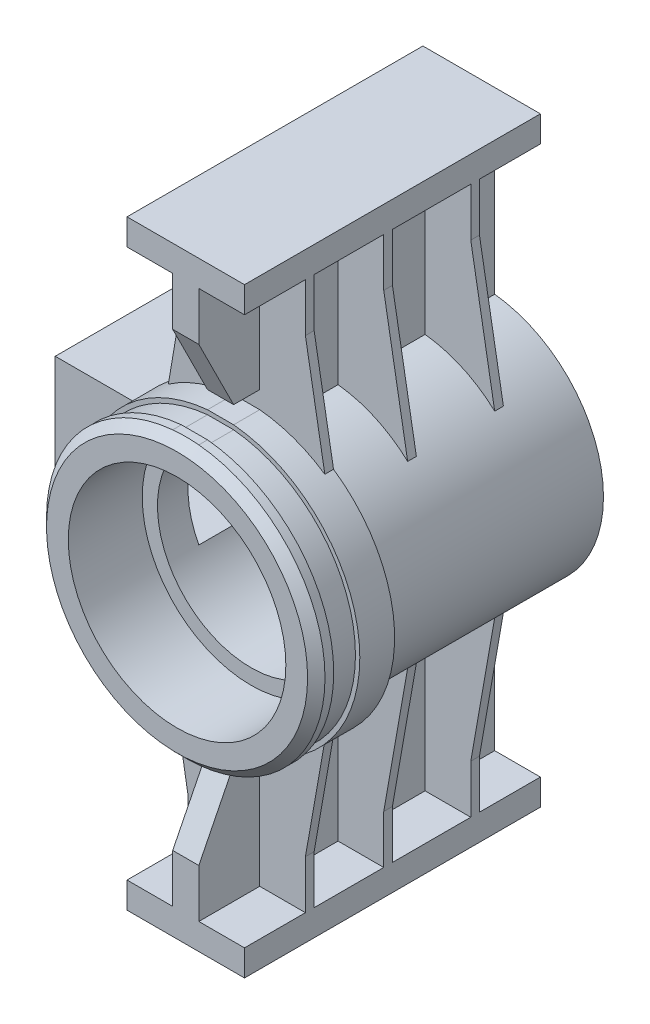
SolidWorks part; units mm, degrees
ref_plane "Plane1" through (0, 0, 0) normal (0, 0, 1) x (1, 0, 0)
ref_plane "Plane2" through (0, 0, 0) normal (0, 1, 0) x (1, 0, 0)
ref_plane "Plane3" through (0, 0, 0) normal (1, 0, 0) x (0, 0, -1)
sketch "Esquisse1" plane through (0, 0, 0) normal (0, 0, 1) x (1, 0, 0)
  circle A0 centre (0, 0) radius 16
  dimension "D1" = 32
extrude "Base-Extrusion" add sketch "Esquisse1" along normal blind 35
chamfer "Chanfrein1" distance 1 angle 45
ref_plane "Plan4" through (0, 0, 33) normal (0, 0, 1) x (1, 0, 0)
sketch "Esquisse2" plane through (0, 0, 33) normal (0, 0, 1) x (1, 0, 0)
  circle A0 centre (0, 0) radius 15.5
  dimension "D1" = 31
extrude "Enlèv. de mat.-Extru.-Mince1" cut sketch "Esquisse2" against normal blind 3 thin
ref_plane "Plan5" through (0, 0, 26) normal (0, 0, 1) x (1, 0, 0)
sketch "Esquisse3" plane through (0, 0, 26) normal (0, 0, 1) x (1, 0, 0)
  circle A0 centre (0, 0) radius 14
  dimension "D1" = 28
extrude "Enlèv. de mat.-Extru.-Mince2" cut sketch "Esquisse3" against normal blind 33 thin
sketch "Esquisse4" plane through (0, 0, 26) normal (0, 0, 1) x (1, 0, 0)
  line L0 (-23, 8.5) -> (-23, -8.5)
  line L1 (-23, 8.5) -> (-7, 8.5)
  line L2 (-23, -8.5) -> (-7, -8.5)
  line L3 (-7, -8.5) -> (-7, 8.5)
  circle A0 centre (0, 0) radius 14 construction
  dimension "D1" = 23
  dimension "D2" = 8.5
  dimension "D3" = 8.5
extrude "Boss.-Extru.1" add sketch "Esquisse4" against normal blind 26
sketch "Esquisse5" plane through (0, 0, 0) normal (0, 0, -1) x (-1, 0, 0)
  line L0 (1.5, -31.5) -> (1.5, -12.7987)
  line L1 (-1.5, -31.5) -> (-1.5, -12.7987)
  line L2 (0, 0) -> (0, -31) construction
  line L3 (6.75, -34.5) -> (-6.75, -34.5)
  line L4 (6.75, -31.5) -> (1.5, -31.5)
  line L5 (-6.75, -34.5) -> (-6.75, -31.5)
  line L6 (6.75, -34.5) -> (6.75, -31.5)
  line L7 (1.5, -12.7987) -> (-1.5, -12.7987)
  line L8 (-1.5, -31.5) -> (-6.75, -31.5)
  line L9 (-30, 0) -> (45, 0) construction
  dimension "D1" = 1.5
  dimension "D2" = 1.5
  dimension "D3" = 3
  dimension "D4" = 34.5
  dimension "D5" = 6.75
  dimension "D6" = 6.75
extrude "Boss.-Extru.2" add sketch "Esquisse5" against normal blind 34
sketch "Esquisse9" plane through (0, 0, 0) normal (0, 0, -1) x (-1, 0, 0)
  line L0 (-1.5, 12.7678) -> (-1.5, 31.5)
  line L1 (1.5, 12.7678) -> (1.5, 31.5)
  line L2 (-1.5, 12.7678) -> (1.5, 12.7678)
  line L3 (-6.75, 31.5) -> (-1.5, 31.5)
  line L4 (-6.75, 34.5) -> (6.75, 34.5)
  line L5 (6.75, 34.5) -> (6.75, 31.5)
  line L6 (-6.75, 34.5) -> (-6.75, 31.5)
  line L7 (1.5, 31.5) -> (6.75, 31.5)
  dimension "D1" = 34.5
  dimension "D2" = 3
extrude "Boss.-Extru.3" add sketch "Esquisse9" against normal blind 34
sketch "Esquisse11" plane through (-1.5, 0, 0) normal (-1, 0, 0) x (0, 0, 1)
  line L0 (34, 15.9295) -> (33, 15.9295)
  line L1 (33, 15.9295) -> (33, 15.4272)
  line L2 (33, 15.4272) -> (30, 15.4272)
  line L3 (30, 15.4272) -> (30, 15.9295)
  line L4 (30, 15.9295) -> (26, 15.9295)
  line L5 (26, 15.9295) -> (26, 17.9295)
  line L6 (26, 17.9295) -> (30, 17.9295)
  line L7 (30, 17.9295) -> (34, 25.9295)
  line L8 (34, 15.9295) -> (34, 31.5) construction
  line L9 (34, 25.9295) -> (34, 15.9295)
  dimension "D1" = 10
  dimension "D2" = 2
extrude "Enlèv. mat.-Extru.2" cut sketch "Esquisse11" against normal blind 10
sketch "Esquisse12" plane through (-1.5, 0, 0) normal (-1, 0, 0) x (0, 0, 1)
  line L0 (34, -15.9295) -> (33, -15.9295)
  line L1 (33, -15.9295) -> (33, -15.4272)
  line L2 (33, -15.4272) -> (30, -15.4272)
  line L3 (30, -15.4272) -> (30, -15.9295)
  line L4 (30, -15.9295) -> (26, -15.9295)
  line L5 (26, -15.9295) -> (26, -17.9295)
  line L6 (26, -17.9295) -> (30, -17.9295)
  line L7 (30, -17.9295) -> (34, -25.9295)
  line L8 (34, -31.5) -> (34, -15.9295) construction
  line L9 (34, -25.9295) -> (34, -15.9295)
  dimension "D1" = 10
  dimension "D2" = 2
extrude "Enlèv. mat.-Extru.3" cut sketch "Esquisse12" against normal blind 10
ref_plane "Plan6" through (0, 0, 8) normal (0, 0, -1) x (-1, 0, 0)
sketch "Esquisse13" plane through (0, 0, 8) normal (0, 0, -1) x (-1, 0, 0)
  line L0 (-6.75, 31.5) -> (-6.75, 25.9295)
  line L1 (-6.75, 25.9295) -> (-9.5, 10.2835)
  line L2 (-9.5, 10.2835) -> (9.5, 10.2835)
  line L3 (9.5, 10.2835) -> (6.75, 26.5)
  line L4 (6.75, 26.5) -> (6.75, 31.5)
  line L5 (6.75, 31.5) -> (-6.75, 31.5)
  line L6 (-32, 0) -> (34, 0) construction
  line L7 (9.5, -10.2835) -> (6.75, -26.5)
  line L8 (6.75, -26.5) -> (6.75, -31.5)
  line L9 (6.75, -31.5) -> (-6.75, -31.5)
  line L10 (-6.75, -31.5) -> (-6.75, -25.9295)
  line L11 (-6.75, -25.9295) -> (-9.5, -10.2835)
  line L12 (-9.5, -10.2835) -> (9.5, -10.2835)
  line L13 (9.5, 10.2835) -> (6.75, 26.5)
  arc A2 (-1.5, 13.9194) -> (-1.5, -13.9194) centre (0, 0) ccw construction
  arc A3 (11.1243, 8.5) -> (1.5, 13.9194) centre (0, 0) ccw construction
  dimension "D1" = 5
  dimension "D2" = 19
extrude "Boss.-Extru.4" add sketch "Esquisse13" along normal blind 1
ref_plane "Plan7" through (0, 0, 17) normal (0, 0, -1) x (-1, 0, 0)
sketch "Esquisse14" plane through (0, 0, 17) normal (0, 0, -1) x (-1, 0, 0)
  line L0 (6.75, 31.5) -> (-6.75, 31.5)
  line L1 (-6.75, 31.5) -> (-6.75, 25.9295)
  line L2 (-6.75, 25.9295) -> (-9.5, 10.2835)
  line L3 (-9.5, 10.2835) -> (9.5, 10.2835)
  line L4 (9.5, 10.2835) -> (6.75, 26.5) construction
  line L5 (9.5, 10.2835) -> (6.75, 26.5)
  line L6 (6.75, 26.5) -> (6.75, 31.5)
  line L7 (-26, 0) -> (42, 0) construction
  line L8 (6.75, -26.5) -> (6.75, -31.5)
  line L9 (9.5, -10.2835) -> (6.75, -26.5)
  line L10 (-9.5, -10.2835) -> (9.5, -10.2835)
  line L11 (-6.75, -25.9295) -> (-9.5, -10.2835)
  line L12 (-6.75, -31.5) -> (-6.75, -25.9295)
  line L13 (6.75, -31.5) -> (-6.75, -31.5)
  arc A0 (-1.5, 13.9194) -> (-1.5, -13.9194) centre (0, 0) ccw construction
  dimension "D1" = 19
extrude "Boss.-Extru.5" add sketch "Esquisse14" against normal blind 1
ref_plane "Plan8" through (0, 0, 27) normal (0, 0, -1) x (-1, 0, 0)
sketch "Esquisse16" plane through (0, 0, 27) normal (0, 0, -1) x (-1, 0, 0)
  line L0 (-6.75, -31.5) -> (6.75, -31.5)
  line L1 (6.75, -31.5) -> (6.75, -26.5)
  line L2 (6.75, -26.5) -> (9.5, -10.2835)
  line L4 (9.5, -10.2835) -> (-9.5, -10.2835)
  line L6 (-9.5, -10.2835) -> (-6.75, -25.9295)
  line L8 (-6.75, -25.9295) -> (-6.75, -31.5)
  line L9 (-28, 0) -> (33, 0) construction
  line L10 (-9.5, 10.2835) -> (-6.75, 25.9295)
  line L11 (-6.75, 25.9295) -> (-6.75, 31.5)
  line L12 (-6.75, 31.5) -> (6.75, 31.5)
  line L13 (6.75, 31.5) -> (6.75, 26.5)
  line L14 (6.75, 26.5) -> (9.5, 10.2835)
  line L15 (9.5, 10.2835) -> (-9.5, 10.2835)
extrude "Boss.-Extru.6" add sketch "Esquisse16" along normal blind 1
sketch "Esquisse17" plane through (0, 0, 0) normal (0, 0, -1) x (-1, 0, 0)
  line L0 (9.5, 5.5) -> (19.9967, 5.5)
  line L1 (19.9967, 5.5) -> (19.9967, -5.5)
  line L2 (19.9967, -5.5) -> (9.5, -5.5)
  line L3 (9.5, -5.5) -> (9.5, 5.5)
  line L4 (23, 8.5) -> (11.1243, 8.5) construction
  line L5 (23, 8.5) -> (23, -8.5) construction
  line L6 (23, -8.5) -> (11.1243, -8.5) construction
  dimension "D1" = 3
  dimension "D2" = 3.0033
  dimension "D3" = 3
extrude "Enlèv. mat.-Extru.4" cut sketch "Esquisse17" against normal blind 23
sketch "Esquisse18" plane through (0, 0, 0) normal (0, 0, -1) x (-1, 0, 0)
  circle A0 centre (0, 0) radius 10.75
  dimension "D1" = 21.5
extrude "Enlèv. mat.-Extru.5" cut sketch "Esquisse18" against normal blind 53
sketch "Esquisse19" plane through (0, 0, 35) normal (0, 0, 1) x (1, 0, 0)
  circle A0 centre (0, 0) radius 12.5
  dimension "D1" = 25
extrude "Enlèv. mat.-Extru.6" cut sketch "Esquisse19" against normal blind 8.5
